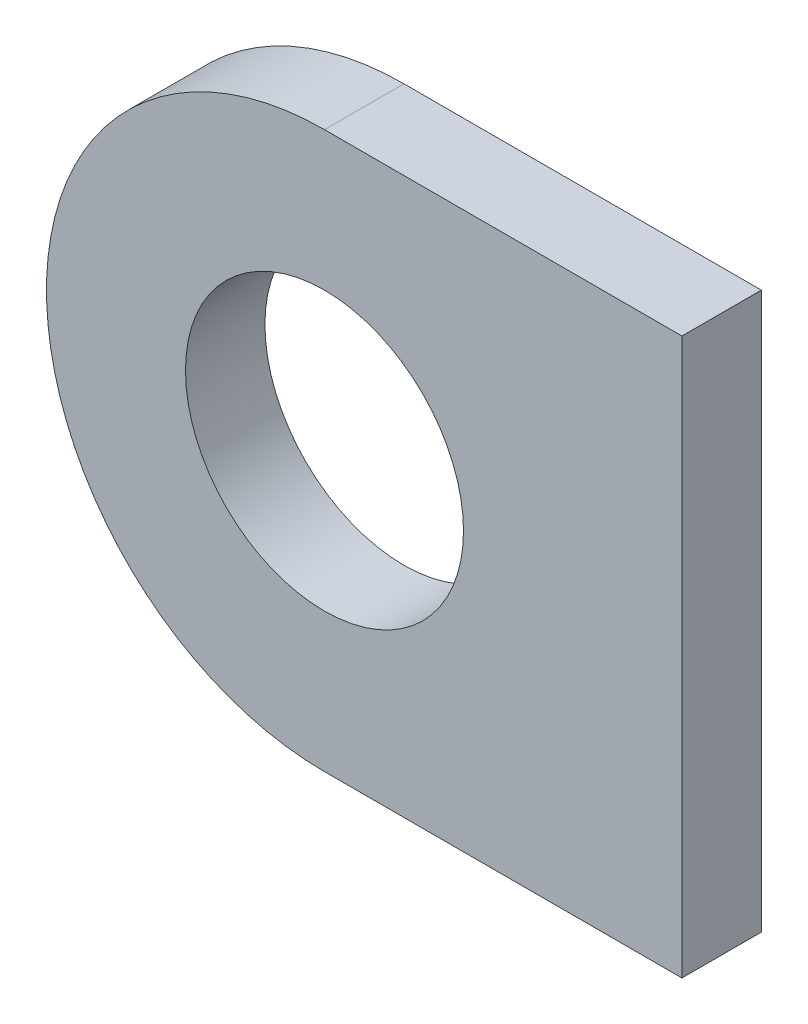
SolidWorks part; units mm, degrees
ref_plane "Front Plane" through (0, 0, 0) normal (0, 0, 1) x (1, 0, 0)
ref_plane "Top Plane" through (0, 0, 0) normal (0, 1, 0) x (1, 0, 0)
ref_plane "Right Plane" through (0, 0, 0) normal (1, 0, 0) x (0, 0, -1)
sketch "Sketch1" plane through (0, 0, 0) normal (0, 0, 1) x (1, 0, 0)
  line L1 (0, 0) -> (-45, 0)
  line L2 (0, 0) -> (0, -70)
  line L3 (0, -70) -> (-45, -70)
  arc A0 (-45, -70) -> (-45, 0) centre (-45, -35) cw
  circle A1 centre (-45, -35) radius 17.5
  dimension "D1" = 45
  dimension "D3" = 35
  dimension "D2" = 70
extrude "Boss-Extrude1" add sketch "Sketch1" along normal blind 10 contours L1 A0 L3 L2
